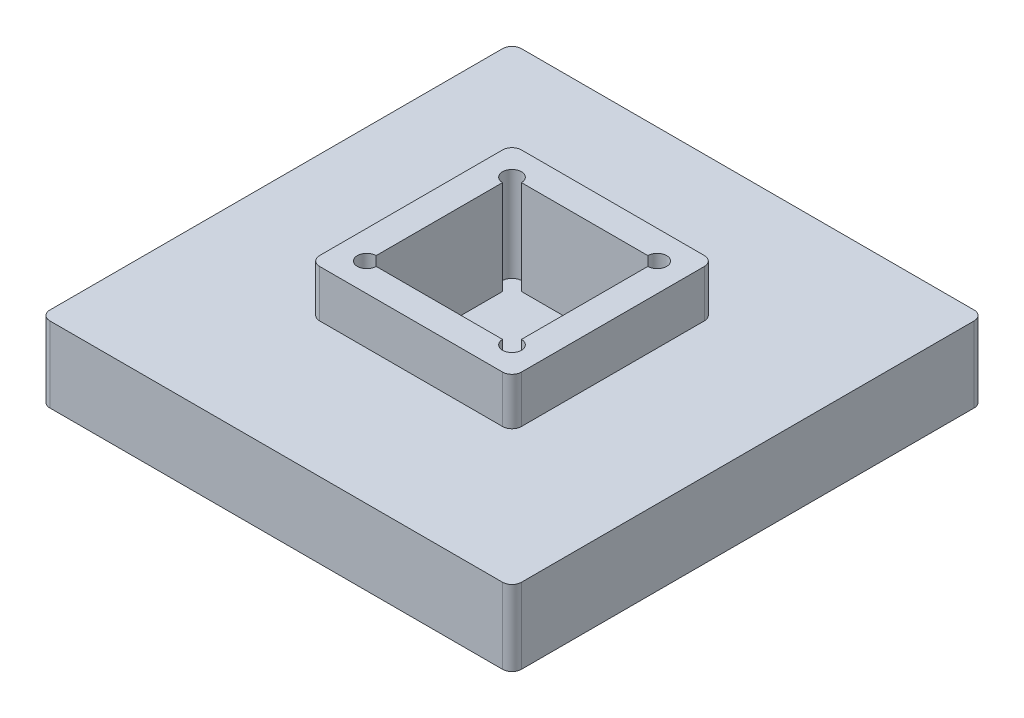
SolidWorks part; units mm, degrees
ref_plane "Front" through (0, 0, 0) normal (0, 0, 1) x (1, 0, 0)
ref_plane "Top" through (0, 0, 0) normal (0, 1, 0) x (1, 0, 0)
ref_plane "Right" through (0, 0, 0) normal (1, 0, 0) x (0, 0, -1)
sketch "草图1" plane through (0, 0, 0) normal (0, 1, 0) x (1, 0, 0)
  line L1 (-25, -25) -> (25, -25)
  line L2 (-25, -25) -> (-25, 25)
  line L3 (-25, 25) -> (25, 25)
  line L4 (25, -25) -> (25, 25)
  line L5 (-25, -25) -> (25, 25) construction
  line L6 (-25, 25) -> (25, -25) construction
  point P0 (0, 0)
  dimension "D1" = 50
  dimension "D2" = 50
extrude "凸台-拉伸1" add sketch "草图1" along normal blind 8
sketch "草图2" plane through (0, 8, 0) normal (0, 1, 0) x (1, 0, 0)
  line L1 (-7.7, -7.7) -> (7.7, -7.7)
  line L2 (-7.7, -7.7) -> (-7.7, 7.7)
  line L3 (-7.7, 7.7) -> (7.7, 7.7)
  line L4 (7.7, -7.7) -> (7.7, 7.7)
  line L5 (-7.7, -7.7) -> (7.7, 7.7) construction
  line L6 (-7.7, 7.7) -> (7.7, -7.7) construction
  line L7 (-10.7, -10.7) -> (10.7, -10.7)
  line L8 (-10.7, -10.7) -> (-10.7, 10.7)
  line L9 (-10.7, 10.7) -> (10.7, 10.7)
  line L10 (10.7, -10.7) -> (10.7, 10.7)
  line L11 (-10.7, -10.7) -> (10.7, 10.7) construction
  line L12 (-10.7, 10.7) -> (10.7, -10.7) construction
  circle A0 centre (-7.7, 7.7) radius 1
  circle A1 centre (7.7, 7.7) radius 1
  circle A2 centre (7.7, -7.7) radius 1
  circle A3 centre (-7.7, -7.7) radius 1
  point P0 (0, 0)
  point P5 (0, 0)
  dimension "D5" = 2
  dimension "D6" = 2
  dimension "D7" = 2
  dimension "D8" = 2
  dimension "D1" = 15.4
  dimension "D2" = 15.4
  dimension "D3" = 3
  dimension "D4" = 3
extrude "凸台-拉伸2" add sketch "草图2" along normal blind 5 contours L7 L10 L9 L8 A3 L2 A0 L3 A1 L4 A2 L1
fillet "圆角1" radius 1 8 edges at (10.7, 10.5, 10.7) (10.7, 10.5, -10.7) (-10.7, 10.5, -10.7) (-10.7, 10.5, 10.7) (-25, 4, -25) (-25, 4, 25) (25, 4, 25) (25, 4, -25)
sketch "草图3" plane through (0, 8, 0) normal (0, 1, 0) x (1, 0, 0)
  line L4 (-7.7, 6.7) -> (-7.7, -6.7)
  line L5 (-6.7, -7.7) -> (6.7, -7.7)
  line L6 (7.7, -6.7) -> (7.7, 6.7)
  line L7 (6.7, 7.7) -> (-6.7, 7.7)
  line L8 (-7.7, 6.7) -> (-7.7, -6.7)
  line L9 (-6.7, -7.7) -> (6.7, -7.7)
  line L10 (7.7, -6.7) -> (7.7, 6.7)
  line L11 (6.7, 7.7) -> (-6.7, 7.7)
  arc A4 (-7.7, -6.7) -> (-6.7, -7.7) centre (-7.7, -7.7) ccw
  arc A5 (6.7, -7.7) -> (7.7, -6.7) centre (7.7, -7.7) ccw
  arc A6 (7.7, 6.7) -> (6.7, 7.7) centre (7.7, 7.7) ccw
  arc A7 (-6.7, 7.7) -> (-7.7, 6.7) centre (-7.7, 7.7) ccw
  arc A8 (-7.7, -6.7) -> (-6.7, -7.7) centre (-7.7, -7.7) ccw
  arc A9 (6.7, -7.7) -> (7.7, -6.7) centre (7.7, -7.7) ccw
  arc A10 (7.7, 6.7) -> (6.7, 7.7) centre (7.7, 7.7) ccw
  arc A11 (-6.7, 7.7) -> (-7.7, 6.7) centre (-7.7, 7.7) ccw
  dimension "D1" = 0
extrude "切除-拉伸1" cut sketch "草图3" against normal blind 5
